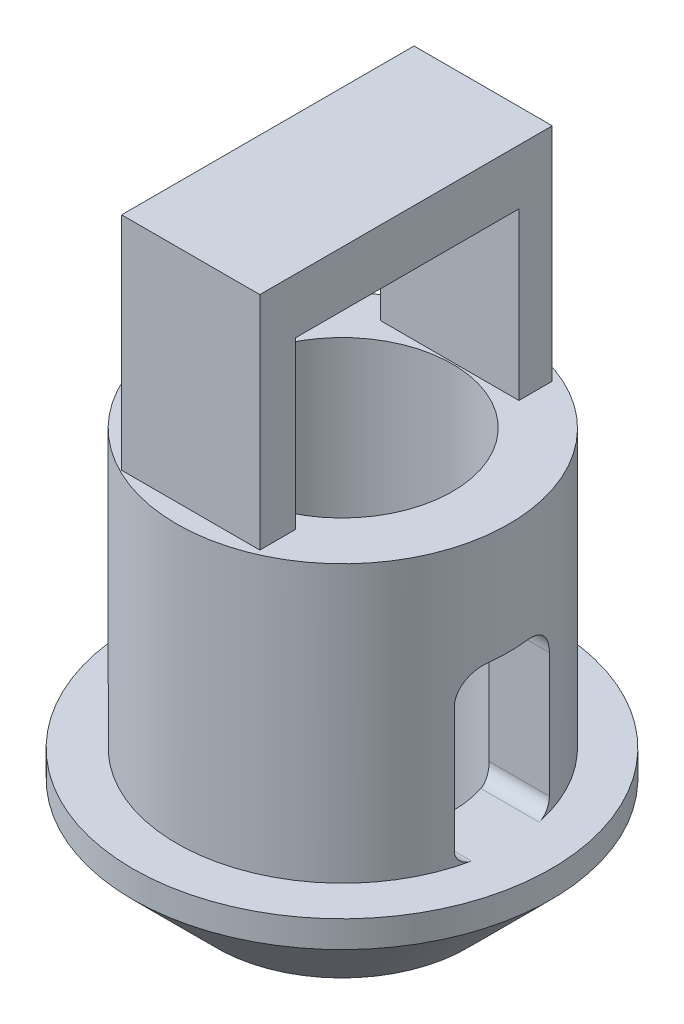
SolidWorks part; units mm, degrees
ref_plane "Спереди" through (0, 0, 0) normal (0, 0, 1) x (1, 0, 0)
ref_plane "Сверху" through (0, 0, 0) normal (0, 1, 0) x (1, 0, 0)
ref_plane "Справа" through (0, 0, 0) normal (1, 0, 0) x (0, 0, -1)
sketch "Эскиз1" plane through (0, 0, 0) normal (0, 1, 0) x (1, 0, 0)
  circle A0 centre (0.2146, 0) radius 6.0047
  dimension "D1" = 12.0093
extrude "Бобышка-Вытянуть1" add sketch "Эскиз1" along normal blind 10.0096
sketch "Эскиз3" plane through (0, 0, 0) normal (0, -1, 0) x (1, 0, 0)
  line L1 (6.5756, 1.7202) -> (-6.5756, 1.7202)
  line L2 (6.5756, 1.7202) -> (6.5756, -1.7202)
  line L3 (6.5756, -1.7202) -> (-6.5756, -1.7202)
  line L4 (-6.5756, 1.7202) -> (-6.5756, -1.7202)
  line L5 (6.5756, 1.7202) -> (-6.5756, -1.7202) construction
  line L6 (6.5756, -1.7202) -> (-6.5756, 1.7202) construction
  point P0 (0, 0)
  dimension "D1" = 3.4405
  dimension "D2" = 0
  dimension "D3" = 0
extrude "Вырез-Вытянуть1" cut sketch "Эскиз3" against normal blind 6
sketch "Эскиз5" plane through (0, 0, 0) normal (0, -1, 0) x (1, 0, 0)
  circle A0 centre (0.2076, 0.0229) radius 7.5698
extrude "Бобышка-Вытянуть2" add sketch "Эскиз5" along normal blind 4
sketch "Эскиз6" plane through (0.1808, 10.0096, 0) normal (0, 1, 0) x (1, 0, 0)
  circle A0 centre (0, 0) radius 4
  dimension "D2" = 8
extrude "Вырез-Вытянуть2" cut sketch "Эскиз6" against normal through all
sketch "Эскиз7" plane through (0, 10.0096, 0) normal (0, 1, 0) x (1, 0, 0)
  line L1 (-2.4708, -4.0241) -> (2.5292, -4.0241)
  line L2 (-2.4708, -4.0241) -> (-2.4708, -5.3173)
  line L3 (-2.4708, -5.3173) -> (2.5292, -5.3173)
  line L4 (2.5292, -4.0241) -> (2.5292, -5.3173)
  line L5 (-2.4708, -4.0241) -> (2.5292, -5.3173) construction
  line L6 (-2.4708, -5.3173) -> (2.5292, -4.0241) construction
  point P0 (0.0292, -4.6707)
  dimension "D1" = 5
extrude "Бобышка-Вытянуть3" add sketch "Эскиз7" along normal blind 8.0054
sketch "Эскиз9" plane through (0, 0, 4.0241) normal (0, 0, -1) x (-1, 0, 0)
  line L0 (-2.5292, 18.015) -> (2.4708, 18.015) construction
  line L1 (2.4708, 18.015) -> (-2.5292, 18.015)
  line L2 (2.4708, 18.015) -> (2.4708, 16.015)
  line L3 (2.4708, 16.015) -> (-2.5292, 16.015)
  line L4 (-2.5292, 18.015) -> (-2.5292, 16.015)
  line L5 (2.4708, 18.015) -> (-2.5292, 16.015) construction
  line L6 (2.4708, 16.015) -> (-2.5292, 18.015) construction
  line L7 (-2.5292, 18.015) -> (-2.5292, 10.0096) construction
  line L8 (2.4708, 18.015) -> (2.4708, 10.0096) construction
  point P0 (-0.0292, 17.015)
  dimension "D1" = 2
extrude "Бобышка-Вытянуть4" add sketch "Эскиз9" along normal blind 9.2862
sketch "Эскиз10" plane through (0, 16.015, 0) normal (0, -1, 0) x (1, 0, 0)
  line L0 (2.5292, -5.2621) -> (-2.4708, -5.2621) construction
  line L1 (2.5292, -5.2621) -> (-2.4708, -5.2621)
  line L2 (2.5292, -5.2621) -> (2.5292, -4.0564)
  line L3 (2.5292, -4.0564) -> (-2.4708, -4.0564)
  line L4 (-2.4708, -5.2621) -> (-2.4708, -4.0564)
  line L5 (2.5292, -5.2621) -> (-2.4708, -4.0564) construction
  line L6 (2.5292, -4.0564) -> (-2.4708, -5.2621) construction
  line L7 (-2.4708, -5.2621) -> (-2.4708, 4.0241) construction
  line L8 (2.5292, -5.2621) -> (2.5292, 4.0241) construction
  point P0 (0.0292, -4.6593)
  dimension "D1" = 1.2057
extrude "Бобышка-Вытянуть5" add sketch "Эскиз10" along normal blind 6.029
fillet "Скругление4" radius 1 4 edges at (-4.4844, 6, 1.7202) (4.8798, 6, 1.7202) (-4.4844, 6, -1.7202) (4.8798, 6, -1.7202)
fillet "Скругление5" radius 0.5 4 edges at (4.8798, 0, -1.7202) (-4.4844, 0, -1.7202) (4.8798, 0, 1.7202) (-4.4844, 0, 1.7202)
chamfer "Фаска1" distance 3.0346 angle 45 1 edges at (0.2076, -4, -7.5468)
